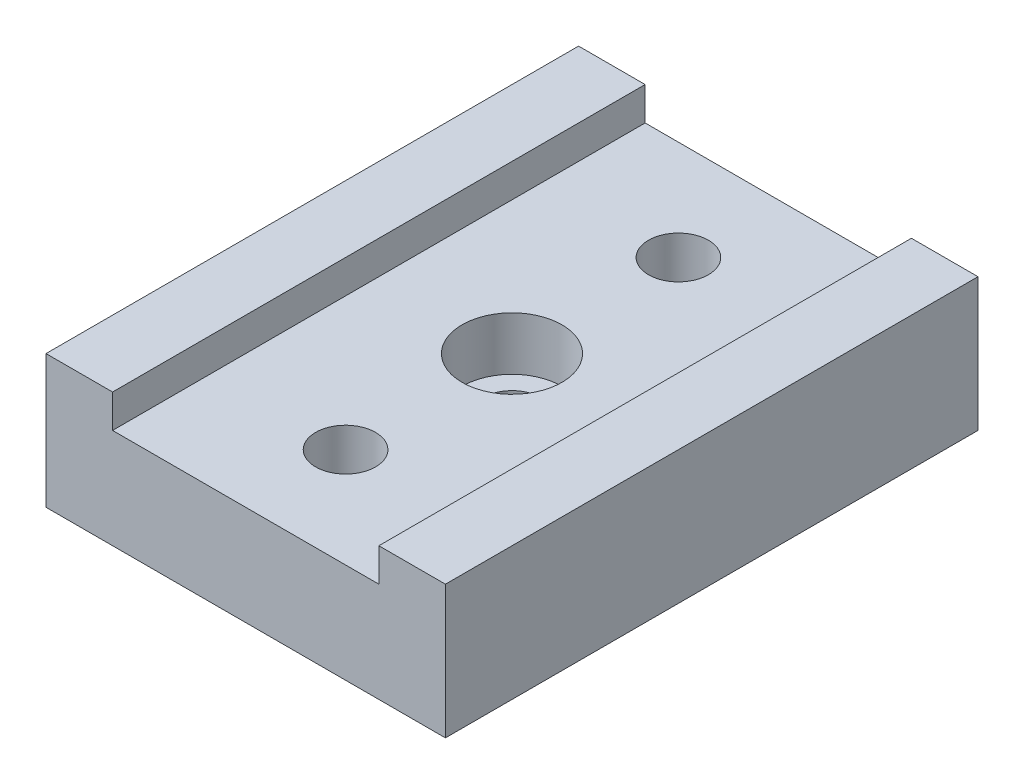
SolidWorks part; units mm, degrees
ref_plane "前基準面" through (0, 0, 0) normal (0, 0, 1) x (1, 0, 0)
ref_plane "上基準面" through (0, 0, 0) normal (0, 1, 0) x (1, 0, 0)
ref_plane "右基準面" through (0, 0, 0) normal (1, 0, 0) x (0, 0, -1)
sketch "草圖2" plane through (0, 0, 0) normal (0, 0, 1) x (1, 0, 0)
  line L0 (0, 0) -> (0, 20)
  line L1 (0, 20) -> (10, 20)
  line L2 (10, 20) -> (10, 15)
  line L3 (10, 15) -> (50, 15)
  line L5 (60, 0) -> (0, 0)
  line L8 (50, 15) -> (50, 20)
  line L9 (50, 20) -> (60, 20)
  line L10 (60, 0) -> (60, 20)
  dimension "D1" = 60
  dimension "D2" = 20
  dimension "D3" = 5
  dimension "D4" = 40
  dimension "D5" = 10
extrude "填料-伸長1" add sketch "草圖2" along normal blind 80
hole_wizard "M8 六角承窩頭蓋螺釘的柱孔1" positions "草圖5" profile "草圖4" counterbore size "M8" standard "ISO"
sketch "草圖5" plane through (0, 15, 0) normal (0, 1, 0) x (-1, 0, 0)
  line L0 (-50, 80) -> (-10, 80) construction
  line L2 (0, 80) -> (0, 0) construction
  point P0 (-30, 40)
  dimension "D1" = 40
  dimension "D2" = 30
sketch "草圖4" plane through (30, 15, 40) normal (1, 0, 0) x (0, 0, 1)
  line L0 (0, 0) -> (0, 15)
  line L1 (0, 15) -> (4.5, 15)
  line L3 (4.5, 15) -> (4.5, 8)
  line L4 (4.5, 8) -> (7.5, 8)
  line L5 (7.5, 8) -> (7.5, 0)
  line L7 (7.5, 0) -> (0, 0)
  line L11 (0, -6.35) -> (0, 107.95) construction
  dimension "貫穿孔直徑" = 9
  dimension "貫穿孔深度" = 15
  dimension "柱孔直徑" = 15
  dimension "柱孔深度" = 8
sketch "草圖6" plane through (0, 0, 0) normal (0, -1, 0) x (1, 0, 0)
  circle A0 centre (30, 40) radius 10
  dimension "D1" = 20
extrude "除料-伸長2" cut sketch "草圖6" against normal blind 2
hole_wizard "M8 六角承窩頭蓋螺釘的柱孔2" positions "草圖10" profile "草圖9" counterbore size "M8" standard "ISO"
sketch "草圖10" plane through (0, 0, 0) normal (0, -1, 0) x (1, 0, 0)
  line L0 (0, 0) -> (60, 0) construction
  line L1 (0, 80) -> (60, 80) construction
  line L2 (0, 80) -> (0, 0) construction
  point P0 (30, 15)
  point P1 (30, 65)
  dimension "D1" = 15
  dimension "D2" = 15
  dimension "D3" = 30
  dimension "D4" = 30
sketch "草圖9" plane through (30, 0, 15) normal (1, 0, 0) x (0, 0, -1)
  line L0 (0, 0) -> (0, 20)
  line L1 (0, 20) -> (4.5, 20)
  line L3 (4.5, 20) -> (4.5, 8)
  line L4 (4.5, 8) -> (7.5, 8)
  line L5 (7.5, 8) -> (7.5, 0)
  line L7 (7.5, 0) -> (0, 0)
  line L11 (0, -6.35) -> (0, 107.95) construction
  dimension "貫穿孔直徑" = 9
  dimension "貫穿孔深度" = 20
  dimension "柱孔直徑" = 15
  dimension "柱孔深度" = 8
